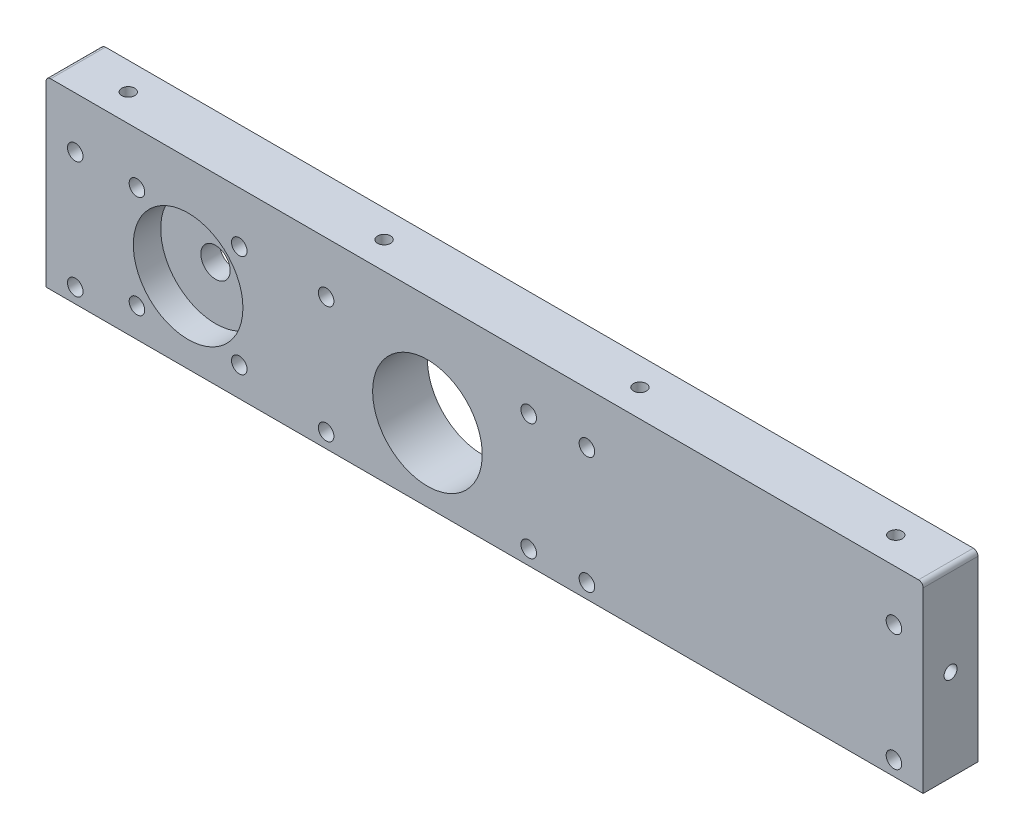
SolidWorks part; units mm, degrees
ref_plane "Front Plane" through (0, 0, 0) normal (0, 0, 1) x (1, 0, 0)
ref_plane "Top Plane" through (0, 0, 0) normal (0, 1, 0) x (1, 0, 0)
ref_plane "Right Plane" through (0, 0, 0) normal (1, 0, 0) x (0, 0, -1)
sketch "Sketch34" plane through (0, 0, 0) normal (0, 0, 1) x (1, 0, 0)
  line L1 (0, -11.9062) -> (152.4, -11.9062)
  line L2 (0, -11.9062) -> (0, 19.0309)
  line L3 (0.8128, 19.8438) -> (151.5872, 19.8438)
  line L4 (152.4, -11.9062) -> (152.4, 19.0309)
  arc A0 (0, 19.0309) -> (0.8128, 19.8438) centre (0.8128, 19.031) cw
  arc A1 (151.5872, 19.8438) -> (152.4, 19.0309) centre (151.5872, 19.031) cw
  dimension "D3" = 0.8128
  dimension "D1" = 31.75
  dimension "D2" = 152.4
sketch "Sketch35" plane through (0, 0, 0) normal (0, 0, 1) x (1, 0, 0)
  circle A1 centre (24.6888, 1.7907) radius 2.5527
  dimension "D1" = 24.6888
  dimension "D3" = 5.1054
  dimension "D2" = 1.7907
sketch "Sketch39" plane through (0, 0, 0) normal (0, 0, -1) x (-1, 0, 0)
  line L0 (0, -11.9062) -> (0, 19.0309) construction
  line L3 (0, -11.9062) -> (-152.4, -11.9062) construction
  circle A0 centre (-66.2686, 0.7938) radius 9.525
  dimension "D1" = 19.05
  dimension "D2" = 66.2686
  dimension "D3" = 12.7
extrude "Extrude1" add sketch "Sketch34" along normal blind 9.525
extrude "Cut-Extrude1" cut sketch "Sketch39" against normal blind 9.525
extrude "Cut-Extrude2" cut sketch "Sketch35" along normal blind 4.7625
sketch "Sketch40" plane through (0, -11.9062, 0) normal (0, -1, 0) x (1, 0, 0)
  line L0 (0, 9.525) -> (0, 0) construction
  line L1 (0, 9.525) -> (152.4, 9.525) construction
  circle A0 centre (9.525, 4.7625) radius 2.0193
  circle A1 centre (53.975, 4.7625) radius 2.0193
  circle A2 centre (98.425, 4.7625) radius 2.0193
  circle A3 centre (142.875, 4.7625) radius 2.0193
  point P2 (0, 4.7625)
  dimension "D1" = 4.0386
  dimension "D2" = 9.525
  dimension "D3" = 4.7625
extrude "Cut-Extrude3" cut sketch "Sketch40" against normal blind 15.875
sketch "Sketch41" plane through (0, 0, 9.525) normal (0, 0, 1) x (1, 0, 0)
  line L1 (66.2686, 0.7938) -> (-8.1904, 0.7938) construction
  line L2 (66.2686, 0.7938) -> (48.671, -9.3663) construction
  circle A0 centre (66.2686, 0.7938) radius 12.7 construction
  circle A1 centre (66.2686, 0.7938) radius 9.525 construction
  circle A2 centre (48.671, -9.3663) radius 1.3526
  circle A3 centre (66.2686, 0.7938) radius 20.32 construction
  circle A4 centre (48.671, 10.9538) radius 1.3526
  circle A7 centre (83.8662, 10.9537) radius 1.3525
  circle A9 centre (83.8662, -9.3663) radius 1.3525
  circle A11 centre (66.2686, 21.1137) radius 1.3525
  circle A12 centre (66.2686, -19.5263) radius 1.3525
  dimension "D1" = 25.4
  dimension "D2" = 2.7051
  dimension "D3" = 30
  dimension "D4" = 20.32
  dimension "D5" = 20.32
extrude "Cut-Extrude4" cut sketch "Sketch41" against normal through all
sketch "Sketch43" plane through (152.4, 0, 0) normal (1, 0, 0) x (0, 0, -1)
  line L0 (-9.525, -11.9062) -> (-9.525, 19.0309) construction
  line L4 (-9.525, -11.9062) -> (0, -11.9062) construction
  circle A0 centre (-4.7625, 3.9688) radius 1.1303
  point P9 (-4.7625, -11.9062)
  dimension "D1" = 2.2606
  dimension "D2" = 15.875
  dimension "D3" = 4.7625
extrude "Cut-Extrude5" cut sketch "Sketch43" against normal blind 9.525
sketch "Sketch44" plane through (0, 0, 0) normal (-1, 0, 0) x (0, 0, 1)
  circle A0 centre (4.7625, 3.9688) radius 1.1303
  circle A1 centre (4.7625, 3.9688) radius 1.1303 construction
  dimension "D1" = 2.2606
extrude "Cut-Extrude6" cut sketch "Sketch44" against normal blind 9.525
sketch "Sketch46" plane through (0, 0, 9.525) normal (0, 0, 1) x (1, 0, 0)
  circle A0 centre (24.6888, 2.0701) radius 9.525
  dimension "D1" = 19.05
  dimension "D2" = 24.6888
  dimension "D3" = 2.0701
extrude "Cut-Extrude7" cut sketch "Sketch46" against normal blind 4.7625
sketch "Sketch47" plane through (0, 0, 0) normal (0, 0, -1) x (-1, 0, 0)
  circle A0 centre (-24.6888, 1.7907) radius 4.7625
  circle A1 centre (-24.6888, 1.7907) radius 2.5527 construction
  dimension "D1" = 9.525
extrude "Cut-Extrude8" cut sketch "Sketch47" against normal blind 1.524
sketch "Sketch48" plane through (0, 19.8438, 0) normal (0, 1, 0) x (-1, 0, 0)
  line L0 (-9.525, 3.6322) -> (-9.525, 5.8928) construction
  circle A0 centre (-9.525, 4.7625) radius 1.1303
  circle A1 centre (-53.975, 4.7625) radius 1.1303
  circle A2 centre (-98.425, 4.7625) radius 1.1303
  circle A3 centre (-142.875, 4.7625) radius 1.1303
  dimension "D1" = 2.2606
extrude "Cut-Extrude9" cut sketch "Sketch48" against normal through all
sketch "Sketch49" plane through (0, 0, 9.525) normal (0, 0, 1) x (1, 0, 0)
  line L1 (24.6888, 2.0701) -> (15.7988, 10.9601) construction
  line L2 (24.6888, 2.0701) -> (4.1649, 2.0701) construction
  circle A0 centre (15.7988, 10.9601) radius 1.3526
  circle A1 centre (33.5788, 10.9601) radius 1.3526
  circle A2 centre (33.5788, -6.8199) radius 1.3526
  circle A3 centre (15.7988, -6.8199) radius 1.3526
  dimension "D1" = 2.7051
  dimension "D2" = 45
  dimension "D3" = 8.89
  dimension "D4" = 8.89
  dimension "D5" = 8.89
extrude "Cut-Extrude10" cut sketch "Sketch49" against normal through all
sketch "Sketch50" plane through (0, 0, 9.525) normal (0, 0, 1) x (1, 0, 0)
  line L0 (0, -11.9062) -> (152.4, -11.9062) construction
  line L1 (0, 19.0309) -> (0, -11.9062) construction
  line L2 (152.4, -11.9062) -> (152.4, 19.0309) construction
  circle A0 centre (5.08, 10.9537) radius 1.3525
  circle A1 centre (147.32, -9.3662) radius 1.3526
  circle A2 centre (5.08, -9.3662) radius 1.3525
  circle A3 centre (147.32, 10.9537) radius 1.3526
  circle A4 centre (93.98, 10.9537) radius 1.3525
  circle A5 centre (93.98, -9.3662) radius 1.3525
  dimension "D1" = 2.7051
  dimension "D4" = 2.54
  dimension "D5" = 5.08
  dimension "D2" = 22.86
  dimension "D3" = 5.08
  dimension "D6" = 53.34
extrude "Cut-Extrude11" cut sketch "Sketch50" against normal through all
